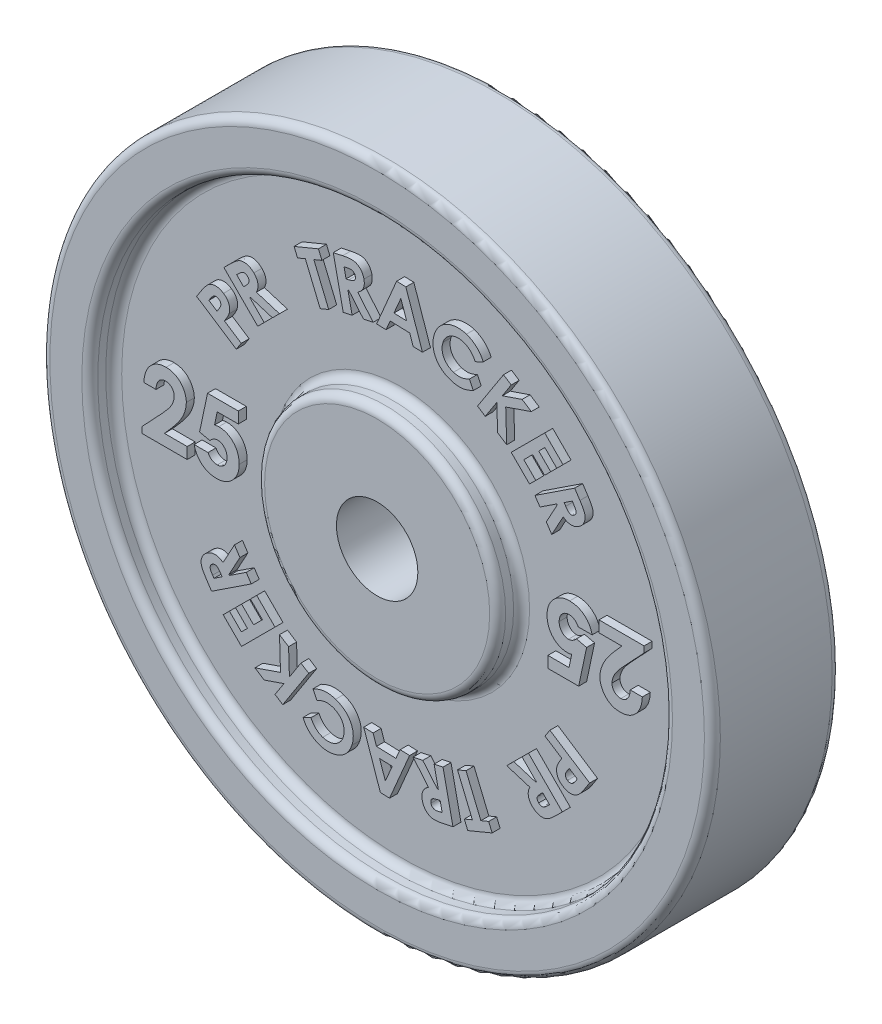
SolidWorks part; units mm, degrees
ref_plane "Plano frontal" through (0, 0, 0) normal (0, 0, 1) x (1, 0, 0)
ref_plane "Plano superior" through (0, 0, 0) normal (0, 1, 0) x (1, 0, 0)
ref_plane "Plano direito" through (0, 0, 0) normal (1, 0, 0) x (0, 0, -1)
sketch "Esboço1" plane through (0, 0, 0) normal (0, 0, 1) x (1, 0, 0)
  circle A0 centre (0, 0) radius 21
  circle A1 centre (0, 0) radius 2.55
  dimension "D1" = 42
  dimension "D2" = 5.1
extrude "Ressalto-extrusão1" add sketch "Esboço1" along normal blind 8
sketch "Esboço2" plane through (0, 0, 8) normal (0, 0, 1) x (1, 0, 0)
  circle A0 centre (0, 0) radius 18
  circle A1 centre (0, 0) radius 21
  circle A2 centre (0, 0) radius 21
  circle A5 centre (0, 0) radius 7.55
  circle A6 centre (0, 0) radius 7.55
  dimension "D1" = 0
  dimension "D2" = 3
  dimension "D3" = 5
extrude "Corte-extrusão1" cut sketch "Esboço2" against normal blind 1.5 contours A0 A6
fillet "Filete1" radius 0.5 4 edges at (7.55, 0, 6.5) (18, 0, 6.5) (7.55, 0, 8) (18, 0, 8)
sketch "Esboço3" plane through (0, 0, 6.5) normal (0, 0, 1) x (1, 0, 0)
  arc A0 (11.25, 0) -> (-11.25, 0) centre (0, 0) ccw construction
  text T0 "<b>PR  TRACKER</b>" font "Century Gothic" height 3
  dimension "D1" = 22.5
extrude "Ressalto-extrusão2" add sketch "Esboço3" along normal blind 0.5
sketch "Esboço5" plane through (0, 0, 6.5) normal (0, 0, 1) x (1, 0, 0)
  line L0 (-17.3735, -2.1) -> (-7.7713, -2.1) construction
  line L1 (0, 0) -> (-17.5, 0) construction
  circle A2 centre (0, 0) radius 17.5 construction
  circle A3 centre (0, 0) radius 8.05 construction
  text T0 "25" font "Century Gothic" height in points 16
  dimension "D1" = 2.1
extrude "Ressalto-extrusão3" add sketch "Esboço5" along normal blind 0.5
pattern_circular "PadrãoCircular1" count 2 over 360 about axis through (0, 0, 8) along (0, 0, 1) of "Ressalto-extrusão2", "Ressalto-extrusão3"
ref_plane "Plano1" through (0, 0, 4) normal (0, 0, 1) x (1, 0, 0)
fillet "Filete2" radius 0.5 2 edges at (21, 0, 0) (21, 0, 8)
mirror "Espelhar6" about plane through (0, 0, 4) normal (0, 0, 1) of "Corte-extrusão1"
fillet "Filete3" radius 0.5 4 edges at (18, 0, 1.5) (7.55, 0, 0) (18, 0, 0) (7.55, 0, 1.5)
sketch "Esboço10" plane through (0, 0, 1.5) normal (0, 0, -1) x (-1, 0, 0)
  line L0 (-11.25, 0) -> (11.25, 0) construction
  arc A0 (11.25, 0) -> (-11.25, 0) centre (0, 0) ccw construction
  text T0 "<b>PR  TRACKER</b>" font "Century Gothic" height 3
  dimension "D1" = 22.5
extrude "Ressalto-extrusão4" add sketch "Esboço10" along normal blind 0.5
sketch "Esboço12" plane through (0, 0, 1.5) normal (0, 0, -1) x (-1, 0, 0)
  line L0 (-17.3735, -2.1) -> (-7.2521, -2.1) construction
  circle A0 centre (0, 0) radius 17.5 construction
  circle A1 centre (0, 0) radius 7.55 construction
  text T0 "<b>25</b>  " font "Century Gothic" height in points 16
  dimension "D1" = 2.1
extrude "Ressalto-extrusão5" add sketch "Esboço12" along normal blind 0.5
pattern_circular "PadrãoCircular2" count 2 over 360 about axis through (0, 0, 0) along (0, 0, 1) of "Ressalto-extrusão4", "Ressalto-extrusão5"
